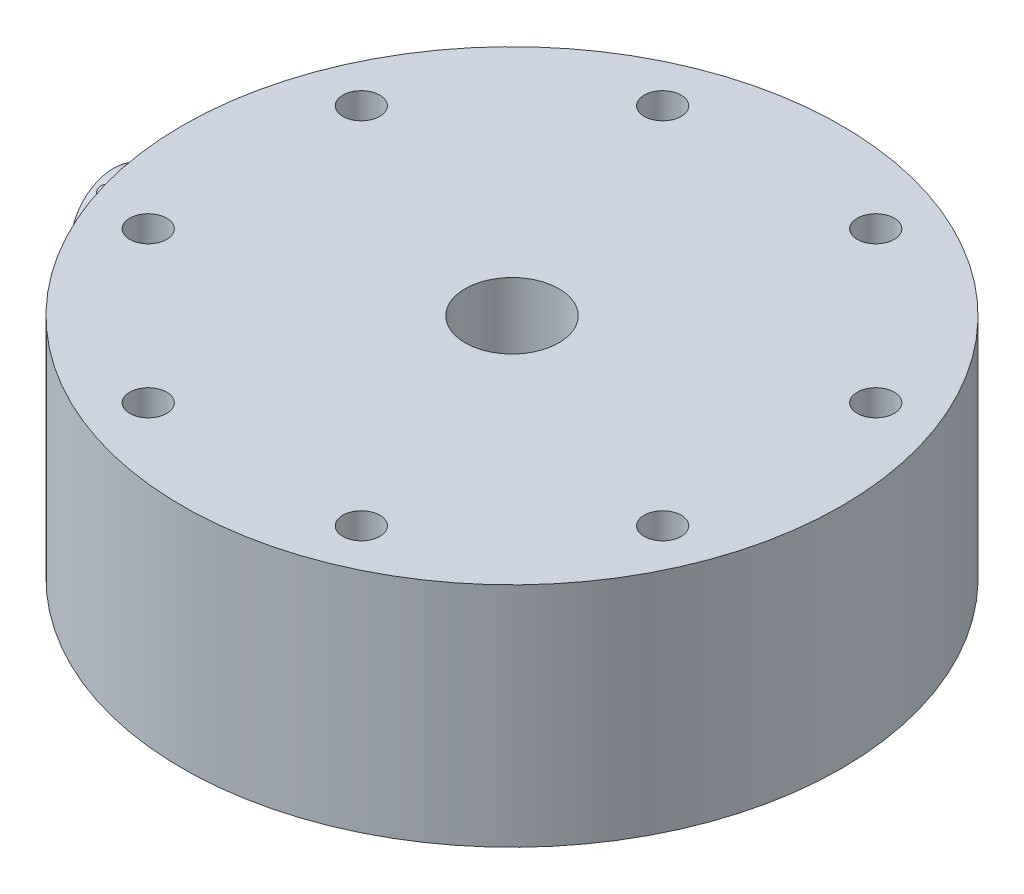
SolidWorks part; units mm, degrees
ref_plane "Piano frontale" through (0, 0, 0) normal (0, 0, 1) x (1, 0, 0)
ref_plane "Piano superiore" through (0, 0, 0) normal (0, 1, 0) x (1, 0, 0)
ref_plane "Piano destro" through (0, 0, 0) normal (1, 0, 0) x (0, 0, -1)
imported_body "TH-1-solid1"
imported_body "CON302-1-solid1"
hole_wizard "Foro Ø6.5 (6.5)-2" positions "Schizzo3" profile "Schizzo1" hole size "Ø6.5" standard "ISO"
sketch "Schizzo3" plane through (0, 40, 0) normal (0, 1, 0) x (1, 0, 0)
  line L0 (-45.2701, 18.7515) -> (0, 0) construction
  line L1 (0, 0) -> (-49.3153, 0) construction
  line L2 (-42.25, 0) -> (-57, 0) construction
  point P0 (-45.2701, 18.7515)
  dimension "D1" = 22.5
  dimension "D2" = 49
sketch "Schizzo1" plane through (-45.2701, 40, -18.7515) normal (1, 0, 0) x (0, 0, 1)
  line L0 (0, 0) -> (0, 40)
  line L1 (0, 40) -> (3.25, 40)
  line L2 (3.25, 40) -> (3.25, 0)
  line L5 (3.25, 0) -> (0, 0)
  line L11 (0, -6.35) -> (0, 107.95) construction
  dimension "Thru Hole Dia." = 6.5
  dimension "Thru Hole Depth" = 40
pattern_circular "RipetizioneCircolare1" count 8 over 360 about axis through (0, 0, 0) along (0, 1, 0) of "Foro Ø6.5 (6.5)-2"
